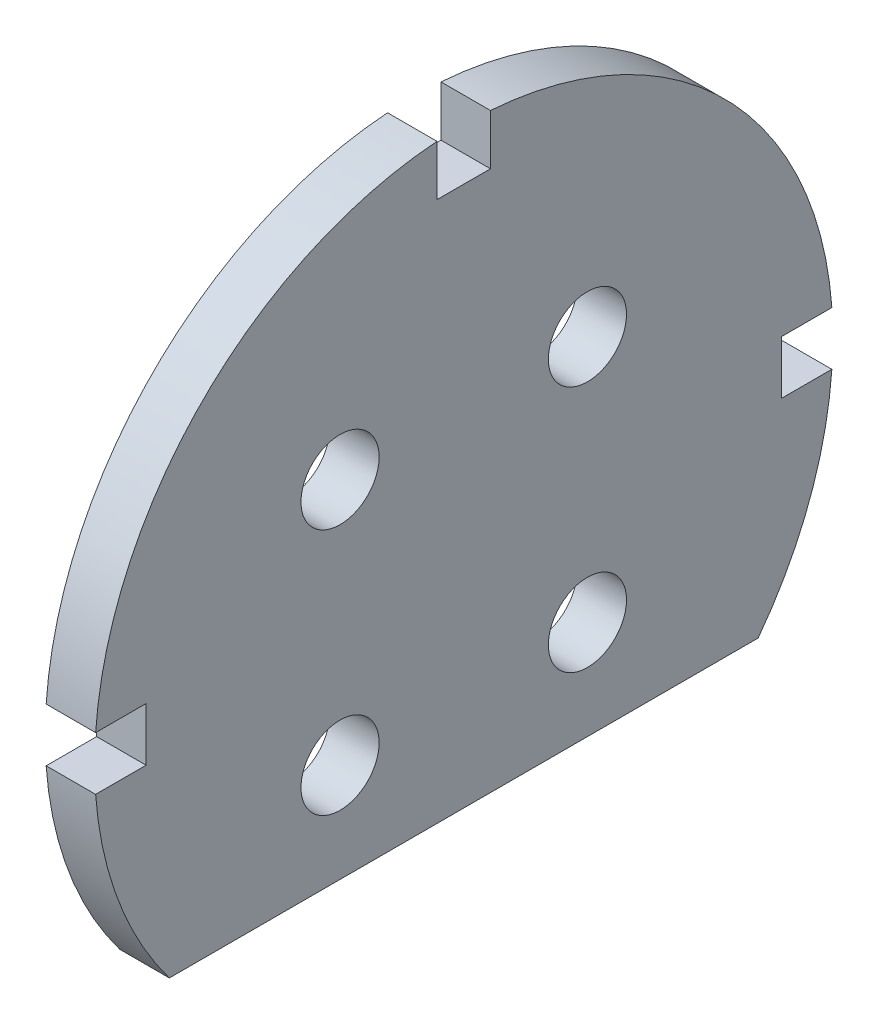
SolidWorks part; units mm, degrees
ref_plane "Front Plane" through (0, 0, 0) normal (0, 0, 1) x (1, 0, 0)
ref_plane "Top Plane" through (0, 0, 0) normal (0, 1, 0) x (1, 0, 0)
ref_plane "Right Plane" through (0, 0, 0) normal (1, 0, 0) x (0, 0, -1)
sketch "Sketch1" plane through (0, 0, 0) normal (1, 0, 0) x (0, 0, -1)
  circle A0 centre (0, 0) radius 47.371
  dimension "D1" = 94.742
extrude "Boss-Extrude1" add sketch "Sketch1" along normal blind 6.35
sketch "Sketch2" plane through (6.35, 0, 0) normal (1, 0, 0) x (0, 0, -1)
  line L0 (-37.782, -28.575) -> (37.782, -28.575)
  circle A0 centre (0, 0) radius 47.371 construction
  arc A1 (-37.782, -28.575) -> (37.782, -28.575) centre (0, 0) ccw
  dimension "D1" = 28.575
extrude "Cut-Extrude1" cut sketch "Sketch2" against normal through all
sketch "Sketch3" plane through (6.35, 0, 0) normal (1, 0, 0) x (0, 0, -1)
  line L1 (-15.875, -15.875) -> (15.875, -15.875)
  line L2 (-15.875, -15.875) -> (-15.875, 15.875)
  line L3 (-15.875, 15.875) -> (15.875, 15.875)
  line L4 (15.875, -15.875) -> (15.875, 15.875)
  line L5 (-15.875, -15.875) -> (15.875, 15.875) construction
  line L6 (-15.875, 15.875) -> (15.875, -15.875) construction
  circle A0 centre (-15.875, 15.875) radius 5.0165
  circle A1 centre (15.875, 15.875) radius 5.0165
  circle A2 centre (15.875, -15.875) radius 5.0165
  circle A3 centre (-15.875, -15.875) radius 5.0165
  point P0 (0, 0)
  dimension "D3" = 10.033
  dimension "D1" = 31.75
  dimension "D2" = 31.75
extrude "Cut-Extrude2" cut sketch "Sketch3" against normal through all contours A0 | A1 | A2 | A3
sketch "Sketch4" plane through (6.35, 0, 0) normal (1, 0, 0) x (0, 0, -1)
  line L1 (-53.975, -3.429) -> (-40.767, -3.429)
  line L2 (-53.975, -3.429) -> (-53.975, 3.429)
  line L3 (-53.975, 3.429) -> (-40.767, 3.429)
  line L4 (-40.767, -3.429) -> (-40.767, 3.429)
  line L5 (-53.975, -3.429) -> (-40.767, 3.429) construction
  line L6 (-53.975, 3.429) -> (-40.767, -3.429) construction
  line L7 (53.975, 3.429) -> (40.767, 3.429)
  line L8 (53.975, 3.429) -> (53.975, -3.429)
  line L9 (53.975, -3.429) -> (40.767, -3.429)
  line L10 (40.767, 3.429) -> (40.767, -3.429)
  line L11 (53.975, 3.429) -> (40.767, -3.429) construction
  line L12 (53.975, -3.429) -> (40.767, 3.429) construction
  arc A0 (37.782, -28.575) -> (-37.782, -28.575) centre (0, 0) ccw construction
  point P0 (-47.371, 0)
  point P8 (47.371, 0)
  dimension "D1" = 13.208
  dimension "D2" = 6.858
  dimension "D3" = 13.208
  dimension "D4" = 6.858
extrude "Cut-Extrude3" cut sketch "Sketch4" against normal through all
sketch "Sketch5" plane through (6.35, 0, 0) normal (1, 0, 0) x (0, 0, -1)
  line L1 (-3.429, 53.975) -> (3.429, 53.975)
  line L2 (-3.429, 53.975) -> (-3.429, 40.767)
  line L3 (-3.429, 40.767) -> (3.429, 40.767)
  line L4 (3.429, 53.975) -> (3.429, 40.767)
  line L5 (-3.429, 53.975) -> (3.429, 40.767) construction
  line L6 (-3.429, 40.767) -> (3.429, 53.975) construction
  arc A0 (47.2467, 3.429) -> (-47.2467, 3.429) centre (0, 0) ccw construction
  point P0 (0, 47.371)
  dimension "D1" = 6.858
  dimension "D2" = 13.208
extrude "Cut-Extrude4" cut sketch "Sketch5" against normal through all
